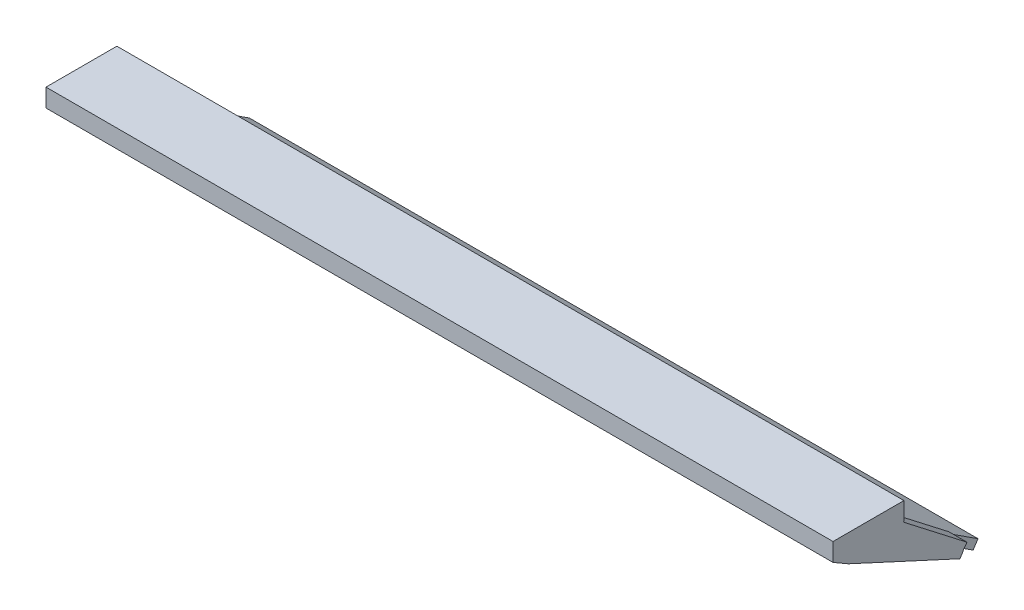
SolidWorks part; units mm, degrees
ref_plane "Front Plane" through (0, 0, 0) normal (0, 0, 1) x (1, 0, 0)
ref_plane "Top Plane" through (0, 0, 0) normal (0, 1, 0) x (1, 0, 0)
ref_plane "Right Plane" through (0, 0, 0) normal (1, 0, 0) x (0, 0, -1)
imported_body "Imported1"
sketch "Sketch1" plane through (0, 4.0127, -2.6011) normal (0, 0.8391, -0.5439) x (-1, 0, 0)
  line L1 (55.9892, -29.856) -> (-56.9296, -29.856)
  line L2 (55.9892, -29.856) -> (55.9892, -13.1623)
  line L3 (55.9892, -13.1623) -> (-56.9296, -13.1623)
  line L4 (-56.9296, -29.856) -> (-56.9296, -13.1623)
extrude "Cut-Extrude1" cut sketch "Sketch1" along normal up to vertex
